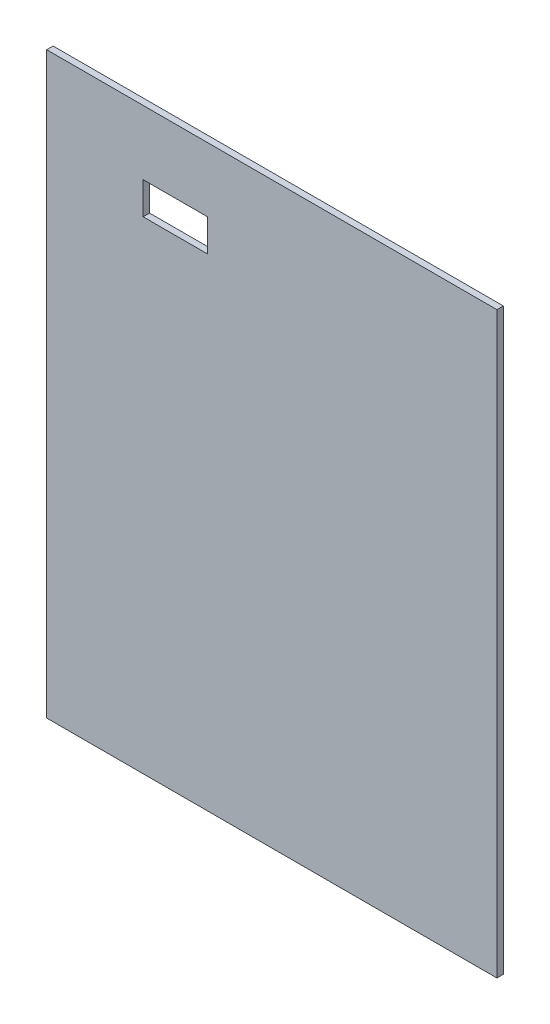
SolidWorks part; units mm, degrees
ref_plane "Front Plane" through (0, 0, 0) normal (0, 0, 1) x (1, 0, 0)
ref_plane "Top Plane" through (0, 0, 0) normal (0, 1, 0) x (1, 0, 0)
ref_plane "Right Plane" through (0, 0, 0) normal (1, 0, 0) x (0, 0, -1)
sketch "Sketch1" plane through (0, 0, 0) normal (0, 0, 1) x (1, 0, 0)
  line L1 (0, 0) -> (350, 0)
  line L2 (0, 0) -> (0, 450)
  line L3 (0, 450) -> (350, 450)
  line L4 (350, 0) -> (350, 450)
  dimension "D1" = 350
  dimension "D2" = 450
extrude "Boss-Extrude1" add sketch "Sketch1" along normal blind 5
sketch "Sketch2" plane through (0, 0, 5) normal (0, 0, 1) x (1, 0, 0)
  line L2 (75, 375) -> (125, 375)
  line L3 (75, 375) -> (75, 400)
  line L4 (75, 400) -> (125, 400)
  line L5 (350, 450) -> (0, 450) construction
  line L6 (175, 450) -> (175, 207.535) construction
  line L7 (125, 375) -> (125, 400)
  line L8 (75, 375) -> (125, 400) construction
  line L9 (75, 400) -> (125, 375) construction
  point P0 (100, 387.5)
  dimension "D1" = 150
  dimension "D2" = 50
  dimension "D3" = 25
  dimension "D4" = 50
extrude "Cut-Extrude1" cut sketch "Sketch2" against normal through all
